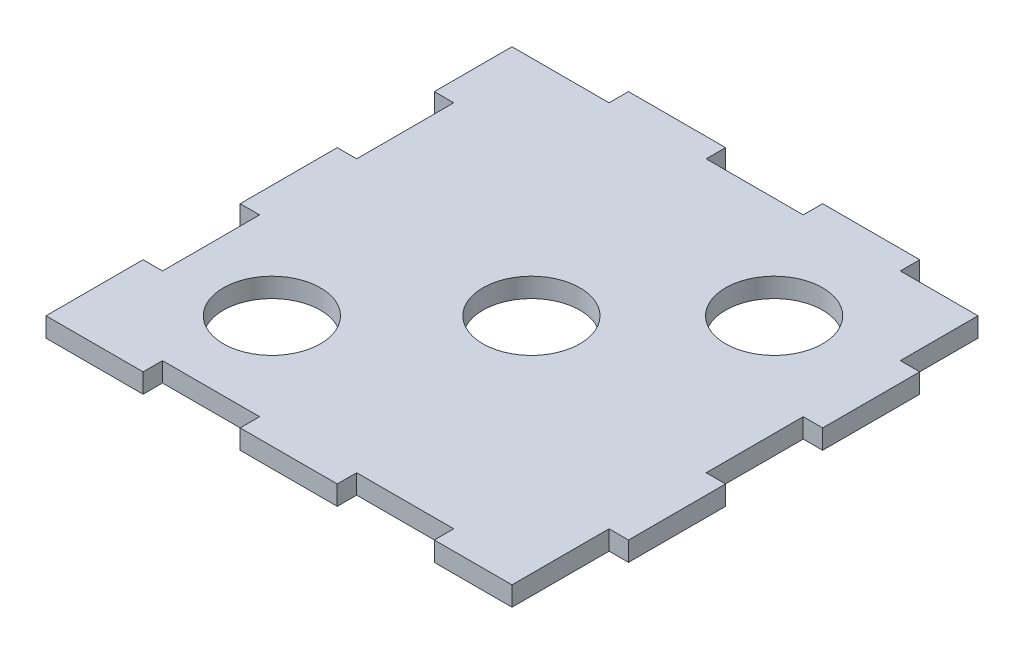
SolidWorks part; units mm, degrees
ref_plane "Front Plane" through (0, 0, 0) normal (0, 0, 1) x (1, 0, 0)
ref_plane "Top Plane" through (0, 0, 0) normal (0, 1, 0) x (1, 0, 0)
ref_plane "Right Plane" through (0, 0, 0) normal (1, 0, 0) x (0, 0, -1)
sketch "Sketch2" plane through (0, 0, 0) normal (0, 1, 0) x (1, 0, 0)
  line L1 (-50, 46) -> (-30, 46)
  line L2 (-50, 46) -> (-50, 30)
  line L3 (-50, -50) -> (-30, -50)
  line L4 (46, 46) -> (46, 30)
  line L8 (-30, 46) -> (-30, 50)
  line L9 (-30, 50) -> (-10, 50)
  line L11 (46, 30) -> (50, 30)
  line L14 (-10, 50) -> (-10, 46)
  line L15 (-10, 46) -> (10, 46)
  line L16 (10, 46) -> (10, 50)
  line L17 (10, 50) -> (30, 50)
  line L18 (30, 50) -> (30, 46)
  line L19 (30, 46) -> (46, 46)
  line L20 (-10, -50) -> (-10, -46)
  line L21 (-10, -46) -> (-30, -46)
  line L22 (-30, -46) -> (-30, -50)
  line L23 (-10, -50) -> (10, -50)
  line L24 (10, -50) -> (10, -46)
  line L25 (10, -46) -> (30, -46)
  line L26 (30, -46) -> (30, -50)
  line L27 (30, -50) -> (46, -50)
  line L29 (50, 30) -> (50, 10)
  line L30 (50, 10) -> (46, 10)
  line L31 (46, 10) -> (46, -10)
  line L32 (46, -10) -> (50, -10)
  line L33 (50, -10) -> (50, -30)
  line L34 (50, -30) -> (46, -30)
  line L35 (46, -30) -> (46, -50)
  line L36 (-50, 30) -> (-46, 30)
  line L37 (-46, 30) -> (-46, 10)
  line L38 (-46, 10) -> (-50, 10)
  line L39 (-50, 10) -> (-50, -10)
  line L40 (-50, -10) -> (-46, -10)
  line L41 (-46, -10) -> (-46, -30)
  line L42 (-46, -30) -> (-50, -30)
  line L43 (-50, -30) -> (-50, -50)
  circle A0 centre (0, 0) radius 10
  circle A1 centre (25, 25) radius 10
  circle A2 centre (-26.7321, -26.7321) radius 10
  point P0 (0, 0)
extrude "Boss-Extrude1" add sketch "Sketch2" along normal blind 4
equation "\"Slit thick\"= 4"
equation "\"Slit wide\"= 20"
equation "\"Piece Thick\"= 4"
equation "\"Slit distance\"= 20"
equation "\"D3@Sketch2\"=\"Slit distance\""
equation "\"D4@Sketch2\"=\"Slit distance\""
equation "\"D6@Sketch2\"=\"Slit wide\""
equation "\"D8@Sketch2\"=\"Slit wide\""
equation "\"D10@Sketch2\"=\"Slit wide\""
equation "\"D12@Sketch2\"=\"Slit thick\""
equation "\"D14@Sketch2\"=\"Slit thick\""
equation "\"D15@Sketch2\"=\"Slit wide\""
equation "\"D16@Sketch2\"=\"Slit distance\""
equation "\"D17@Sketch2\"=\"Slit wide\""
equation "\"D18@Sketch2\"=\"Slit distance\""
equation "\"D20@Sketch2\"=\"Slit thick\""
equation "\"D21@Sketch2\"=\"Slit wide\""
equation "\"D22@Sketch2\"=\"Slit distance\""
equation "\"D23@Sketch2\"=\"Slit wide\""
equation "\"D24@Sketch2\"=\"Slit distance\""
equation "\"diam\"= 20"
equation "\"D25@Sketch2\"=\"diam\""
equation "\"D26@Sketch2\"=\"diam\""
equation "\"D27@Sketch2\"=\"diam\""
equation "\"D1@Boss-Extrude1\"=\"Piece Thick\""
